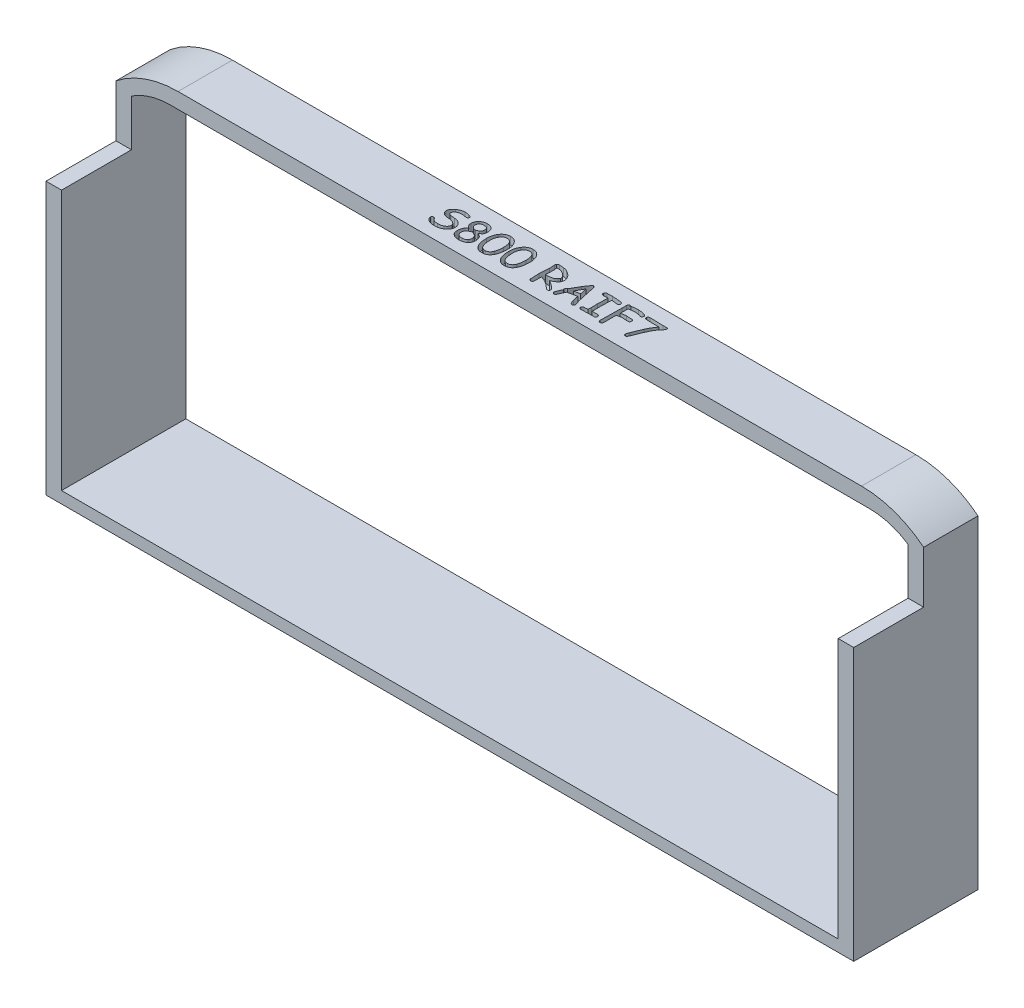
SolidWorks part; units mm, degrees
ref_plane "Piano frontale" through (0, 0, 0) normal (0, 0, 1) x (1, 0, 0)
ref_plane "Piano superiore" through (0, 0, 0) normal (0, 1, 0) x (1, 0, 0)
ref_plane "Piano destro" through (0, 0, 0) normal (1, 0, 0) x (0, 0, -1)
sketch "Schizzo1" plane through (0, 0, 0) normal (0, 0, 1) x (1, 0, 0)
  line L1 (50, -23) -> (-50, -23)
  line L2 (50, -23) -> (50, 23)
  line L3 (50, 23) -> (-50, 23)
  line L4 (-50, -23) -> (-50, 23)
  line L5 (50, -23) -> (-50, 23) construction
  line L6 (50, 23) -> (-50, -23) construction
  point P0 (0, 0)
  dimension "D1" = 100
  dimension "D2" = 46
extrude "Estrusione-Estrusione1" add sketch "Schizzo1" along normal blind 7
sketch "Schizzo2" plane through (0, 0, 7) normal (0, 0, 1) x (1, 0, 0)
  line L0 (50, -23) -> (50, 23) construction
  line L1 (-50, -23) -> (50, -23)
  line L2 (-50, -23) -> (-50, 16)
  line L3 (-50, 16) -> (50, 16)
  line L4 (50, -23) -> (50, 16)
  dimension "D1" = 39
extrude "Estrusione-Estrusione2" add sketch "Schizzo2" along normal blind 9
sketch "Schizzo4" plane through (0, 0, 0) normal (0, 0, -1) x (-1, 0, 0)
  line L0 (50, -23) -> (-50, -23) construction
  line L1 (-27, 15) -> (19, 15)
  line L2 (-27, 15) -> (-27, -20)
  line L3 (-27, -20) -> (19, -20)
  line L4 (19, 15) -> (19, -20)
  line L5 (50, 23) -> (50, -23) construction
  dimension "D1" = 3
  dimension "D2" = 31
  dimension "D3" = 46
  dimension "D4" = 35
extrude "Taglio-Estrusione1" cut sketch "Schizzo4" against normal through all
sketch "Schizzo5" plane through (0, 0, 16) normal (0, 0, 1) x (1, 0, 0)
  line L0 (50, 16) -> (-50, 16) construction
  line L1 (28, 16) -> (38, 16)
  line L2 (28, 16) -> (28, 14)
  line L3 (28, 14) -> (38, 14)
  line L4 (38, 16) -> (38, 14)
  line L5 (50, 16) -> (-50, 16) construction
  line L6 (-38, 16) -> (-28, 16)
  line L7 (-38, 16) -> (-38, 14)
  line L8 (-38, 14) -> (-28, 14)
  line L9 (-28, 16) -> (-28, 14)
  line L10 (50, -23) -> (50, 16) construction
  line L11 (-50, 16) -> (-50, -23) construction
  dimension "D1" = 10
  dimension "D2" = 2
  dimension "D3" = 12
  dimension "D4" = 12
extrude "Taglio-Estrusione2" cut sketch "Schizzo5" against normal blind 5
sketch "Schizzo6" plane through (-50, 0, 0) normal (-1, 0, 0) x (0, 0, 1)
  line L0 (0, 23) -> (0, -23) construction
  line L1 (16, -23) -> (0, -23) construction
  circle A0 centre (8, -10) radius 3
  dimension "D3" = 6
  dimension "D1" = 8
  dimension "D2" = 13
extrude "Taglio-Estrusione3" cut sketch "Schizzo6" against normal through all
sketch "Schizzo7" plane through (0, 0, 0) normal (0, 0, -1) x (-1, 0, 0)
  line L0 (50, 23) -> (50, -23) construction
  line L1 (-50, -23) -> (50, -23)
  line L2 (-50, -23) -> (-50, -20)
  line L3 (-50, -20) -> (50, -20)
  line L4 (50, -23) -> (50, -20)
  line L5 (-27, -20) -> (19, -20) construction
extrude "Taglio-Estrusione4" [suppressed] cut sketch "Schizzo7" against normal through all
sketch "Schizzo8" plane through (0, 0, 7) normal (0, 0, 1) x (1, 0, 0)
  line L0 (-50, 23) -> (-50, 16) construction
  line L1 (50, 23) -> (-50, 23) construction
  line L2 (-50, 21.5) -> (-51.8017, 26.913)
  line L3 (-51.8017, 26.913) -> (-44, 23)
  line L4 (0, 48.1624) -> (0, -15.5948) construction
  line L5 (50, 21.5) -> (51.8017, 26.913)
  line L6 (51.8017, 26.913) -> (44, 23)
  arc A0 (-50, 21.5) -> (-44, 23) centre (-44, 10.25) cw
  arc A1 (50, 21.5) -> (44, 23) centre (44, 10.25) ccw
  dimension "D1" = 1.5
  dimension "D2" = 6
extrude "Taglio-Estrusione5" cut sketch "Schizzo8" against normal through all
sketch "Schizzo9" plane through (0, 0, 16) normal (0, 0, 1) x (1, 0, 0)
  line L0 (-50, 16) -> (-50, -23) construction
  line L1 (50, 16) -> (-50, 16) construction
  line L2 (-38, 16) -> (-50, 16) construction
  line L3 (-50, 13.5) -> (-54.5009, 20.6424)
  line L4 (-54.5009, 20.6424) -> (-41, 16)
  line L5 (0, 32.4135) -> (0, -8.075) construction
  line L6 (54.5009, 20.6424) -> (41, 16)
  line L7 (50, 13.5) -> (54.5009, 20.6424)
  arc A0 (-50, 13.5) -> (-41, 16) centre (-41, -1.45) cw
  arc A1 (50, 13.5) -> (41, 16) centre (41, -1.45) ccw
  dimension "D1" = 9
  dimension "D2" = 2.5
extrude "Taglio-Estrusione7" cut sketch "Schizzo9" against normal up to surface (9 mm away)
sketch "Schizzo10" plane through (0, 23, 0) normal (0, 1, 0) x (1, 0, 0)
  line L0 (0, 13.5432) -> (0, -24.6114) construction
  line L1 (-36.186, -5.3311) -> (36.186, -5.3311) construction
  text T0 "S800 RAIF7" font "Comic Sans MS" height 3.5
extrude "Taglio-Estrusione8" cut sketch "Schizzo10" against normal blind 1
sketch "Schizzo11" plane through (0, 0, 16) normal (0, 0, 1) x (1, 0, 0)
  line L0 (50, -23) -> (50, 13.5) construction
  line L1 (-50, -23) -> (50, -23)
  line L2 (-50, -23) -> (-50, -21.5)
  line L3 (-50, -21.5) -> (50, -21.5)
  line L4 (50, -23) -> (50, -21.5)
  line L5 (27, -20) -> (-19, -20) construction
  dimension "D1" = 1.5
extrude "Taglio-Estrusione9" cut sketch "Schizzo11" against normal through all
sketch "Schizzo12" plane through (0, 0, 16) normal (0, 0, 1) x (1, 0, 0)
  line L0 (50, -21.5) -> (-50, -21.5) construction
  line L1 (-50, 13.5) -> (-50, -21.5) construction
  circle A0 centre (-40, 3.5) radius 7.5
  dimension "D1" = 15
  dimension "D2" = 25
  dimension "D3" = 10
extrude "Taglio-Estrusione10" cut sketch "Schizzo12" against normal through all
sketch "Schizzo13" plane through (-50, 0, 0) normal (-1, 0, 0) x (0, 0, 1)
  line L0 (0, 21.5) -> (7, 21.5)
  line L1 (7, 21.5) -> (7, 13.5)
  line L2 (7, 13.5) -> (16, 13.5)
  line L3 (16, 13.5) -> (16, -21.5)
  line L4 (16, -21.5) -> (0, -21.5)
  line L5 (0, -21.5) -> (0, 21.5)
extrude "Estrusione-Estrusione3" add sketch "Schizzo13" along normal blind 2
sketch "Schizzo14" plane through (50, 0, 0) normal (1, 0, 0) x (0, 0, -1)
  line L0 (-16, 13.5) -> (-7, 13.5)
  line L1 (-7, 13.5) -> (-7, 21.5)
  line L2 (-7, 21.5) -> (0, 21.5)
  line L3 (0, 21.5) -> (0, -21.5)
  line L4 (0, -21.5) -> (-16, -21.5)
  line L5 (-16, -21.5) -> (-16, 13.5)
extrude "Estrusione-Estrusione4" add sketch "Schizzo14" along normal blind 2
sketch "Schizzo15" plane through (0, 0, 16) normal (0, 0, 1) x (1, 0, 0)
  line L0 (27, -20) -> (-19, -20) construction
  line L1 (-50, -20) -> (50, -20)
  line L2 (-50, -20) -> (-50, 19.5)
  line L3 (-50, 19.5) -> (50, 19.5) construction
  line L4 (50, -20) -> (50, 19.5)
  line L5 (-52, -21.5) -> (-52, 13.5) construction
  line L6 (52, 13.5) -> (52, -21.5) construction
  line L7 (-45, 21) -> (45, 21)
  line L8 (44, 23) -> (-44, 23) construction
  line L9 (0, 38.2273) -> (0, -28.8238) construction
  arc A0 (-45, 21) -> (-50, 19.5) centre (-45, 11.9167) ccw
  arc A1 (45, 21) -> (50, 19.5) centre (45, 11.9167) cw
  dimension "D1" = 2
  dimension "D2" = 2
  dimension "D3" = 2
  dimension "D4" = 2
  dimension "D5" = 90
extrude "Taglio-Estrusione11" cut sketch "Schizzo15" against normal through all
sketch "Schizzo17" plane through (-52, 0, 0) normal (-1, 0, 0) x (0, 0, 1)
  circle A0 centre (8, -10) radius 3
extrude "Taglio-Estrusione12" cut sketch "Schizzo17" against normal through all
sketch "Schizzo18" plane through (0, 0, 0) normal (0, 0, -1) x (-1, 0, 0)
  line L0 (-44, 23) -> (44, 23)
  line L1 (54.185, 17.92) -> (56.3209, 35.9778)
  line L2 (56.3209, 35.9778) -> (-56.8144, 32.0583)
  line L3 (-56.8144, 32.0583) -> (-58.5971, 16.9863)
  line L4 (-58.5971, 16.9863) -> (-56.8144, 18.3919)
  line L5 (-53.8118, 18.3919) -> (-56.8144, 18.3919)
  arc A0 (44, 23) -> (54.185, 17.92) centre (44, 10.25) cw
  arc A1 (-44, 23) -> (-53.8118, 18.3919) centre (-44, 10.25) ccw
  arc A2 (-44, 23) -> (-50, 21.5) centre (-44, 10.25) ccw construction
  arc A3 (50, 21.5) -> (44, 23) centre (44, 10.25) ccw construction
extrude "Taglio-Estrusione13" cut sketch "Schizzo18" against normal through all
sketch "Schizzo19" plane through (52, 0, 0) normal (1, 0, 0) x (0, 0, -1)
  circle A0 centre (-8, -10) radius 3
extrude "Estrusione-Estrusione5" add sketch "Schizzo19" against normal blind 2
sketch "Schizzo20" plane through (-52, 0, 0) normal (-1, 0, 0) x (0, 0, 1)
  circle A0 centre (8, -10) radius 3
extrude "Estrusione-Estrusione6" add sketch "Schizzo20" against normal blind 2
